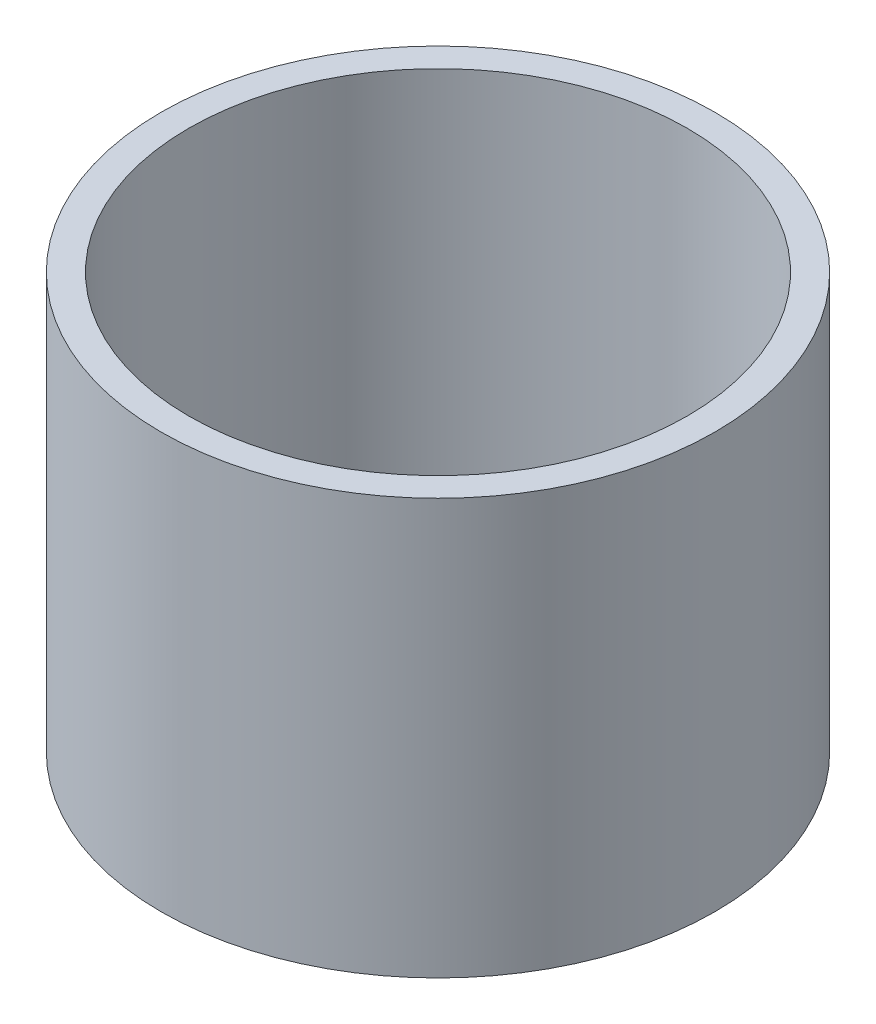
SolidWorks part; units mm, degrees
ref_plane "Plano frontal" through (0, 0, 0) normal (0, 0, 1) x (1, 0, 0)
ref_plane "Plano superior" through (0, 0, 0) normal (0, 1, 0) x (1, 0, 0)
ref_plane "Plano direito" through (0, 0, 0) normal (1, 0, 0) x (0, 0, -1)
sketch "Esboço2" plane through (0, 0, 0) normal (0, 1, 0) x (1, 0, 0)
  circle A0 centre (0, 0) radius 100
  circle A1 centre (0, 0) radius 90
  dimension "D1" = 180
  dimension "D2" = 200
extrude "Ressalto-extrusão2" add sketch "Esboço2" along normal blind 150
